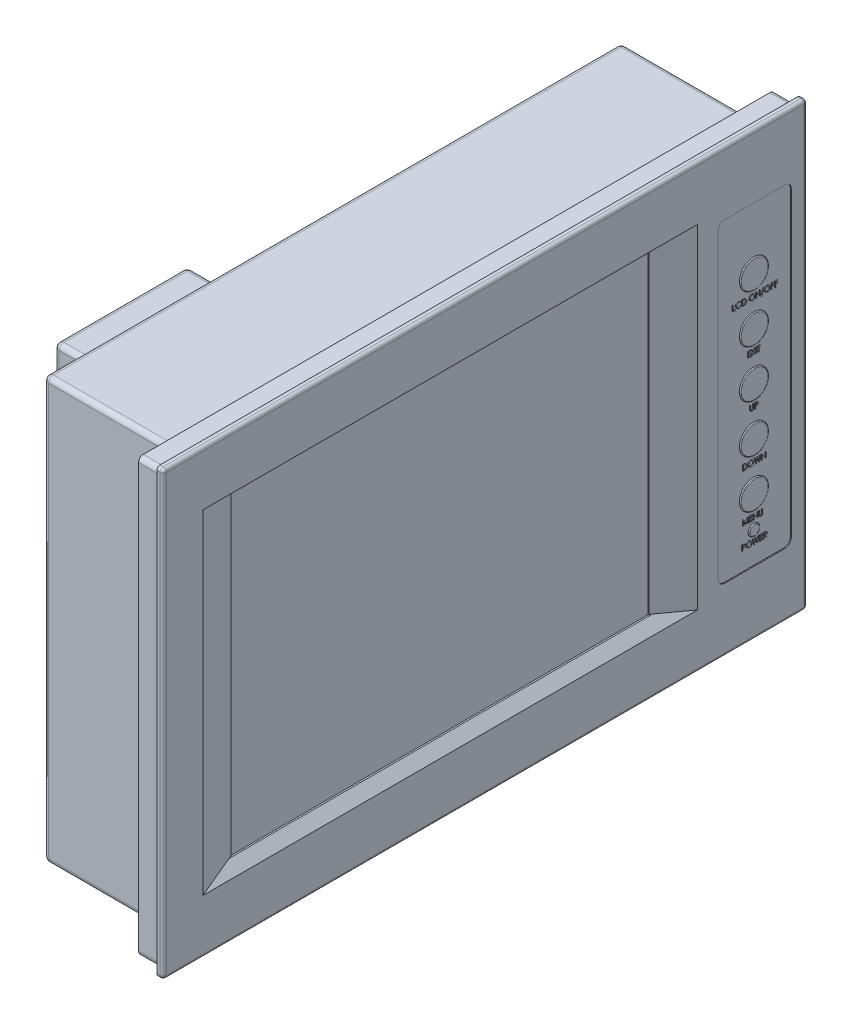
SolidWorks part; units mm, degrees
ref_plane "Plan1" through (0, 0, 0) normal (0, 0, 1) x (1, 0, 0)
ref_plane "Plan2" through (0, 0, 0) normal (0, 1, 0) x (1, 0, 0)
ref_plane "Plan3" through (0, 0, 0) normal (1, 0, 0) x (0, 0, -1)
sketch "Esquisse2" plane through (0, 0, 0) normal (0, 1, 0) x (1, 0, 0)
  line L0 (0, -101.25) -> (0, 101.25)
  line L1 (0, -101.25) -> (-2, -101.25)
  line L2 (-2, -101.25) -> (-2, -100)
  line L3 (-2, -100) -> (-10, -100)
  line L4 (-10, -100) -> (-10, -90.75)
  line L5 (-10, -90.75) -> (-48, -90.75)
  line L6 (-48, -90.75) -> (-48, 90.75)
  line L7 (-75.8913, 0) -> (75.8913, 0) construction
  line L8 (-10, 90.75) -> (-48, 90.75)
  line L9 (-10, 100) -> (-10, 90.75)
  line L10 (-2, 100) -> (-10, 100)
  line L11 (-2, 101.25) -> (-2, 100)
  line L12 (0, 101.25) -> (-2, 101.25)
  point P12 (-48, 0)
  dimension "D1" = 2
  dimension "D2" = 200
  dimension "D3" = 8
  dimension "D4" = 38
  dimension "D5" = 202.5
  dimension "D6" = 181.5
extrude "Base-Extrusion" add sketch "Esquisse2" along normal mid plane 139
sketch "Esquisse3" plane through (0, 0, 0) normal (0, 0, 1) x (1, 0, 0)
  line L0 (-56.417, 0) -> (20.5645, 0) construction
  line L1 (-2, 69.5) -> (-2, 68)
  line L2 (-2, 68) -> (-9, 68)
  line L3 (-9, 68) -> (-9, 66.25)
  line L4 (-9, 66.25) -> (-48, 66.25)
  line L5 (-48, 66.25) -> (-48, 69.5)
  line L6 (-48, 69.5) -> (-2, 69.5)
  line L7 (-48, 69.5) -> (-10, 69.5) construction
  line L8 (-48, 69.5) -> (-48, -69.5) construction
  line L9 (-2, 69.5) -> (-2, -69.5) construction
  line L10 (-48, -69.5) -> (-2, -69.5)
  line L11 (-48, -66.25) -> (-48, -69.5)
  line L12 (-9, -66.25) -> (-48, -66.25)
  line L13 (-9, -68) -> (-9, -66.25)
  line L14 (-2, -68) -> (-9, -68)
  line L15 (-2, -69.5) -> (-2, -68)
  dimension "D1" = 132.5
  dimension "D2" = 136
  dimension "D3" = 7
extrude "Enlèv. mat.-Extru.1" cut sketch "Esquisse3" against normal through all and the other way through all
sketch "Esquisse10" plane through (0, 0, 0) normal (0, 1, 0) x (1, 0, 0)
  line L0 (-48, 90.75) -> (-10, 90.75) construction
  line L1 (-10, 100) -> (-9, 100)
  line L2 (-10, 100) -> (-10, 90.75)
  line L3 (-10, 90.75) -> (-9, 90.75)
  line L4 (-9, 100) -> (-9, 90.75)
  line L5 (-9, 100) -> (-9, -100) construction
  line L6 (-9, 100) -> (-2, 100) construction
  line L7 (-10, 90.75) -> (-10, 100) construction
  line L8 (-78.4404, 0) -> (29.7319, 0) construction
  line L9 (-9, -100) -> (-9, -90.75)
  line L10 (-10, -90.75) -> (-9, -90.75)
  line L11 (-10, -100) -> (-10, -90.75)
  line L12 (-10, -100) -> (-9, -100)
extrude "Enlèv. mat.-Extru.5" cut sketch "Esquisse10" against normal through all and the other way through all
sketch "Esquisse4" plane through (-48, 0, 0) normal (-1, 0, 0) x (0, 0, 1)
  line L0 (-84.364, 0) -> (15.2827, 0) construction
  line L1 (24.65, 52.5) -> (66.45, 52.5)
  line L2 (24.65, 52.5) -> (24.65, -52.5)
  line L3 (24.65, -52.5) -> (66.45, -52.5)
  line L4 (66.45, 52.5) -> (66.45, -52.5)
  line L5 (45.55, 52.4735) -> (45.55, -54.417) construction
  dimension "D1" = 41.8
  dimension "D2" = 105
  dimension "D3" = 45.55
extrude "Boss.-Extru.1" add sketch "Esquisse4" along normal blind 21
sketch "Esquisse5" plane through (0, 0, 24.65) normal (0, 0, -1) x (-1, 0, 0)
  line L0 (49.3619, 0) -> (63.25, 0) construction
  line L1 (58.5, 12.475) -> (58.5, -12.475) construction
  line L2 (63.25, 7.5) -> (63.25, -7.5)
  line L3 (61.4361, -9.022) -> (55.0271, -7.892)
  line L4 (53.75, -6.3699) -> (53.75, 6.3699)
  line L5 (55.0271, 7.892) -> (61.4361, 9.022)
  line L6 (48, 66.25) -> (48, -66.25) construction
  line L7 (69, -52.5) -> (69, 52.5) construction
  circle A0 centre (58.5, -12.475) radius 1.55
  circle A1 centre (58.5, 12.475) radius 1.55
  arc A2 (61.4361, -9.022) -> (63.25, -7.5) centre (61.7045, -7.5) ccw
  arc A3 (55.0271, -7.892) -> (53.75, -6.3699) centre (55.2955, -6.3699) cw
  arc A4 (63.25, 7.5) -> (61.4361, 9.022) centre (61.7045, 7.5) ccw
  arc A5 (53.75, 6.3699) -> (55.0271, 7.892) centre (55.2955, 6.3699) cw
  dimension "D4" = 3.1
  dimension "D5" = 24.95
  dimension "D6" = 1.5455
  dimension "D1" = 9.5
  dimension "D2" = 15
  dimension "D3" = 80
extrude "Boss.-Extru.2" add sketch "Esquisse5" along normal blind 5
fillet "Congé1" radius 1
sketch "Esquisse6" plane through (0, 0, 19.65) normal (0, 0, -1) x (-1, 0, 0)
  line L1 (56.95, -11.5801) -> (56.95, -13.3699)
  line L2 (56.95, -13.3699) -> (58.5, -14.2648)
  line L3 (58.5, -14.2648) -> (60.05, -13.3699)
  line L4 (60.05, -13.3699) -> (60.05, -11.5801)
  line L5 (60.05, -11.5801) -> (58.5, -10.6852)
  line L6 (58.5, -10.6852) -> (56.95, -11.5801)
  line L7 (56.95, 13.3699) -> (56.95, 11.5801)
  line L8 (56.95, 11.5801) -> (58.5, 10.6852)
  line L9 (58.5, 10.6852) -> (60.05, 11.5801)
  line L10 (60.05, 11.5801) -> (60.05, 13.3699)
  line L11 (60.05, 13.3699) -> (58.5, 14.2648)
  line L12 (58.5, 14.2648) -> (56.95, 13.3699)
  circle A0 centre (58.5, -12.475) radius 1.55 construction
  circle A2 centre (58.5, -12.475) radius 1.55 construction
  circle A3 centre (58.5, 12.475) radius 1.55 construction
  circle A4 centre (58.5, 12.475) radius 1.55 construction
extrude "Boss.-Extru.3" add sketch "Esquisse6" along normal up to surface (5 mm away)
sketch "Esquisse7" plane through (0, 0, 19.65) normal (0, 0, -1) x (-1, 0, 0)
  circle A0 centre (58.5, -12.475) radius 1
  circle A1 centre (58.5, -12.475) radius 1.55 construction
  circle A2 centre (58.5, 12.475) radius 1
  dimension "D1" = 2
extrude "Enlèv. mat.-Extru.2" cut sketch "Esquisse7" against normal up to surface (5 mm away)
pattern_linear "Répétition linéaire1" count 2 spacing 31
sketch "Esquisse8" plane through (0, 0, 0) normal (1, 0, 0) x (0, 0, -1)
  line L0 (-90.7244, 0) -> (90.7244, 0) construction
  line L1 (-76.75, 49.5) -> (54.75, 49.5)
  line L2 (-76.75, 49.5) -> (-76.75, -49.5)
  line L3 (-76.75, -49.5) -> (54.75, -49.5)
  line L4 (54.75, 49.5) -> (54.75, -49.5)
  line L5 (-11, 60.0707) -> (-11, -62.1908) construction
  line L6 (-101.25, 69.5) -> (-101.25, -69.5) construction
  dimension "D1" = 99
  dimension "D2" = 131.5
  dimension "D3" = 24.5
extrude "Enlèv. mat.-Extru.3" cut sketch "Esquisse8" against normal blind 3.5
chamfer "Chanfrein1" distance 3 angle 45
chamfer "Chanfrein2" distance 12 angle 15
sketch "Esquisse9" plane through (0, 0, 0) normal (1, 0, 0) x (0, 0, -1)
  line L0 (-77.5538, -49.5) -> (55.5538, -49.5) construction
  line L1 (75.25, 49.5) -> (94.25, 49.5)
  line L2 (73.25, 47.5) -> (73.25, -47.5)
  line L3 (75.25, -49.5) -> (94.25, -49.5)
  line L4 (96.25, 47.5) -> (96.25, -47.5)
  line L5 (55.5538, 49.5) -> (-77.5538, 49.5) construction
  line L6 (101.25, 69.5) -> (101.25, -69.5) construction
  arc A0 (94.25, 49.5) -> (96.25, 47.5) centre (94.25, 47.5) cw
  arc A1 (73.25, 47.5) -> (75.25, 49.5) centre (75.25, 47.5) cw
  arc A2 (75.25, -49.5) -> (73.25, -47.5) centre (75.25, -47.5) cw
  arc A3 (94.25, -49.5) -> (96.25, -47.5) centre (94.25, -47.5) ccw
  point P10 (96.25, 49.5)
  point P13 (73.25, 49.5)
  dimension "D2" = 2
  dimension "D1" = 23
  dimension "D3" = 5
extrude "Enlèv. mat.-Extru.4" cut sketch "Esquisse9" against normal blind 0.3
fillet "Congé2" radius 1
fillet "Congé3" radius 1.5
fillet "Congé4" radius 1.5
sketch "Esquisse11" plane through (-0.3, 0, 0) normal (1, 0, 0) x (0, 0, -1)
  line L0 (69.523, 0) -> (117.4028, 0) construction
  line L2 (84.75, 0) -> (84.75, -15) construction
  line L3 (84.75, -15) -> (84.75, -30) construction
  line L4 (96.25, -47.5) -> (96.25, 47.5) construction
  line L5 (73.25, 47.5) -> (73.25, -47.5) construction
  line L6 (65.659, -30) -> (103.841, -30) construction
  line L7 (68.0918, -39.75) -> (101.4082, -39.75) construction
  line L8 (75.25, -49.5) -> (94.25, -49.5) construction
  circle A0 centre (84.75, 0) radius 4.5
  circle A1 centre (84.75, -15) radius 4.5
  circle A2 centre (84.75, -30) radius 4.5
  circle A3 centre (84.75, 30) radius 4.5
  circle A4 centre (84.75, 15) radius 4.5
  circle A5 centre (84.75, -39.75) radius 1.75
  dimension "D2" = 9
  dimension "D3" = 3.5
  dimension "D1" = 15
extrude "Boss.-Extru.4" add sketch "Esquisse11" along normal up to surface (0.3 mm away)
fillet "Congé7" radius 0.3
sketch "Esquisse12" plane through (-0.3, 0, 0) normal (1, 0, 0) x (0, 0, -1)
  text T0 "LCD ON/OFF"
  dimension "D1" = 7
  dimension "D2" = 7
extrude "Boss.-Extru.5" add sketch "Esquisse12" along normal up to surface (0.3 mm away)
sketch "Esquisse13" plane through (-0.3, 0, 0) normal (1, 0, 0) x (0, 0, -1)
  text T0 "EXIT"
  point P1 (0, 0)
  dimension "D1" = 7
  dimension "D2" = 2.25
extrude "Boss.-Extru.6" add sketch "Esquisse13" along normal up to surface (0.3 mm away)
sketch "Esquisse14" plane through (-0.3, 0, 0) normal (1, 0, 0) x (0, 0, -1)
  text T0 "UP"
  point P1 (0, 0)
  dimension "D1" = 7
  dimension "D2" = 1.5
extrude "Boss.-Extru.7" add sketch "Esquisse14" along normal up to surface (0.3 mm away)
sketch "Esquisse15" plane through (-0.3, 0, 0) normal (1, 0, 0) x (0, 0, -1)
  text T0 "DOWN"
  point P1 (0, 0)
  dimension "D1" = 7
  dimension "D2" = 3.75
extrude "Boss.-Extru.8" add sketch "Esquisse15" along normal up to surface (0.3 mm away)
sketch "Esquisse16" plane through (-0.3, 0, 0) normal (1, 0, 0) x (0, 0, -1)
  text T0 "MENU"
  point P1 (0, 0)
  dimension "D1" = 7
  dimension "D2" = 3.75
extrude "Boss.-Extru.9" add sketch "Esquisse16" along normal up to surface (0.3 mm away)
sketch "Esquisse17" plane through (-0.3, 0, 0) normal (1, 0, 0) x (0, 0, -1)
  line L0 (68.0918, -39.75) -> (101.4082, -39.75) construction
  text T0 "POWER"
  point P0 (91.7252, -43.9856)
  dimension "D1" = 4
  dimension "D2" = 4
extrude "Boss.-Extru.10" add sketch "Esquisse17" along normal up to surface (0.3 mm away)
